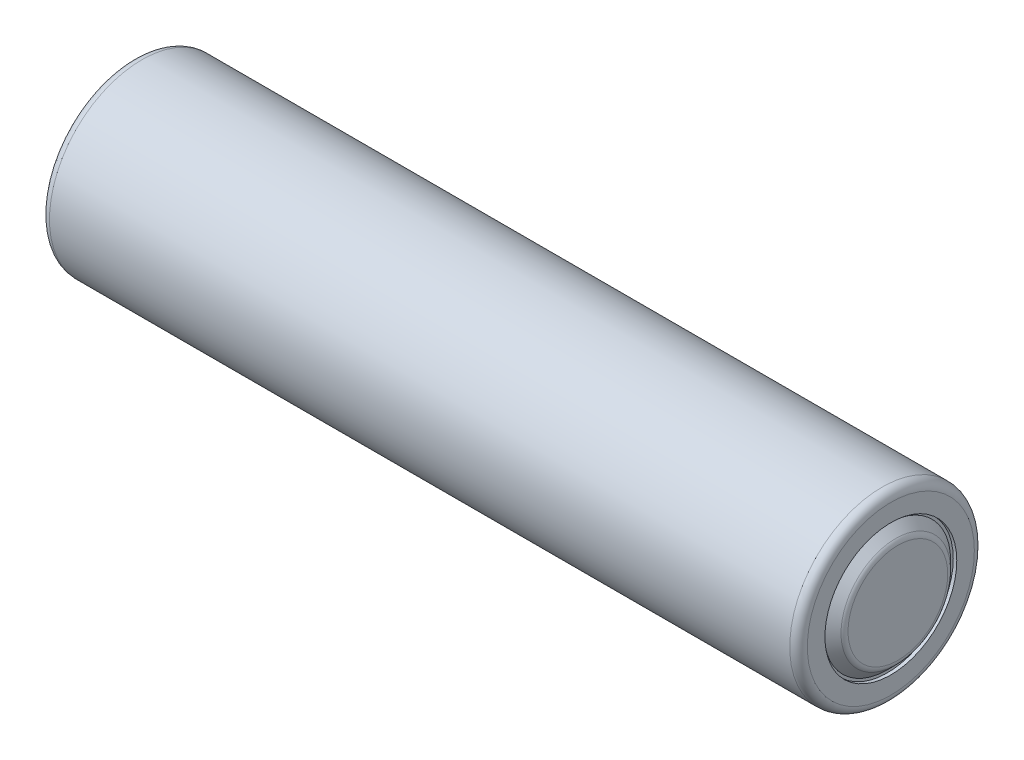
SolidWorks part; units mm, degrees
ref_plane "Face" through (0, 0, 0) normal (0, 0, 1) x (1, 0, 0)
ref_plane "Dessus" through (0, 0, 0) normal (0, 1, 0) x (1, 0, 0)
ref_plane "Droite" through (0, 0, 0) normal (1, 0, 0) x (0, 0, -1)
sketch "Esquisse1" plane through (0, 0, 0) normal (0, 0, 1) x (1, 0, 0)
  line L0 (102.4724, 0) -> (-87.4997, 0) construction
  line L1 (0, 0) -> (0, 0.884)
  line L2 (0.25, 1.317) -> (0.75, 1.6057)
  line L3 (1, 2.0387) -> (1, 2.7113)
  line L4 (1.25, 3.1443) -> (1.5, 3.2887)
  line L5 (1.5, 3.2887) -> (1.5, 4)
  line L6 (1.5, 4) -> (1, 4)
  line L7 (1, 4) -> (1, 4.75)
  line L8 (1.5, 5.25) -> (43.6, 5.25)
  line L9 (44.1, 4.75) -> (44.1, 3.75)
  line L10 (44.1, 3.75) -> (43.9, 3.75)
  line L11 (43.9, 3.75) -> (43.9, 3.6)
  line L12 (43.9, 3.6) -> (44.3828, 3.1172)
  line L13 (44.5, 2.8343) -> (44.5, 0)
  line L14 (44.5, 0) -> (0, 0)
  arc A0 (44.3828, 3.1172) -> (44.5, 2.8343) centre (44.1, 2.8343) cw
  arc A1 (43.6, 5.25) -> (44.1, 4.75) centre (43.6, 4.75) cw
  arc A2 (1, 4.75) -> (1.5, 5.25) centre (1.5, 4.75) cw
  arc A3 (0, 0.884) -> (0.25, 1.317) centre (0.5, 0.884) cw
  arc A4 (0.75, 1.6057) -> (1, 2.0387) centre (0.5, 2.0387) ccw
  arc A5 (1, 2.7113) -> (1.25, 3.1443) centre (1.5, 2.7113) cw
  point P19 (44.5, 3)
  point P28 (1, 1.75)
  point P31 (1, 3)
  dimension "D15" = 0.4
  dimension "D16" = 0.5
  dimension "D1" = 3.5
  dimension "D2" = 1
  dimension "D3" = 30
  dimension "D4" = 6
  dimension "D5" = 30
  dimension "D6" = 0.5
  dimension "D7" = 8
  dimension "D8" = 10.5
  dimension "D9" = 6
  dimension "D10" = 45
  dimension "D11" = 0.4
  dimension "D12" = 0.2
  dimension "D13" = 7.5
  dimension "D14" = 44.5
revolve "Révolution1" add sketch "Esquisse1" angle 360 about L0
